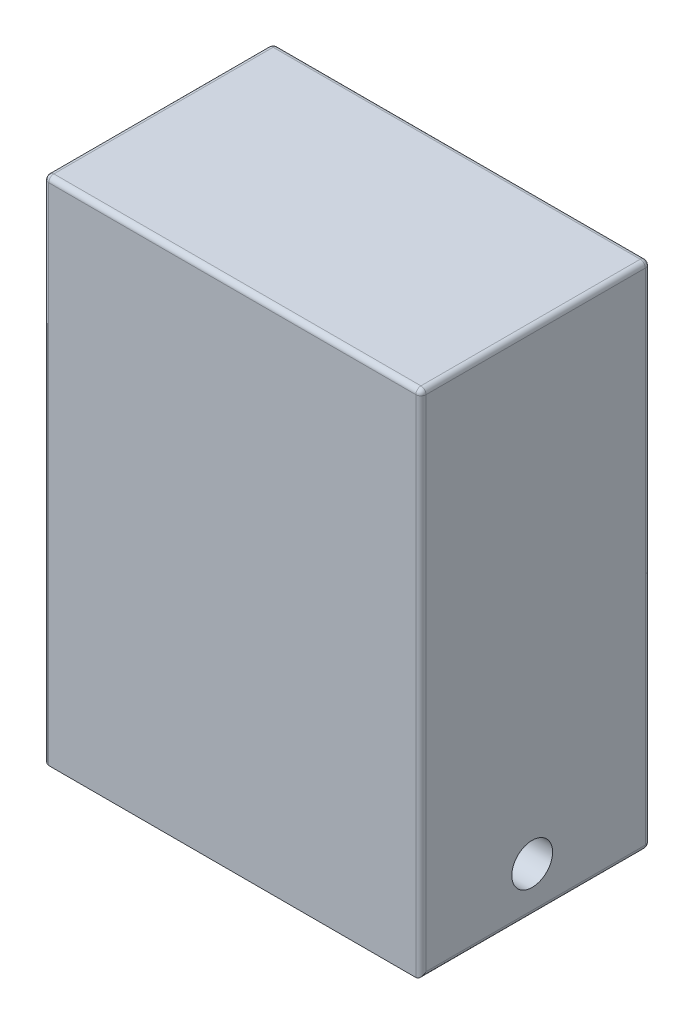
SolidWorks part; units mm, degrees
ref_plane "Front Plane" through (0, 0, 0) normal (0, 0, 1) x (1, 0, 0)
ref_plane "Top Plane" through (0, 0, 0) normal (0, 1, 0) x (1, 0, 0)
ref_plane "Right Plane" through (0, 0, 0) normal (1, 0, 0) x (0, 0, -1)
body saved out of another part "Stock-AirJetCasing-1"
sketch "Sketch1" plane through (0, 7.0644, 0) normal (0, 1, 0) x (1, 0, 0)
  line L0 (2.8086, -12.3746) -> (12.7, -12.3746) construction
  line L1 (12.7, -17.1291) -> (12.7, -7.62) construction
  circle A1 centre (6.4294, -12.7) radius 3.6354 construction
sketch "Sketch2" plane through (14.6844, 0, 0) normal (1, 0, 0) x (0, 0, -1)
  line L0 (-12.3746, 7.0644) -> (-12.3746, 0) construction
  line L3 (-3.175, 7.0644) -> (-20.6375, 7.0644) construction
  line L4 (-3.175, 18.6531) -> (-3.175, 0.3969) construction
  line L5 (-20.6375, 39.2906) -> (-20.6375, 0.3969) construction
  line L6 (-3.175, 0) -> (-20.6375, 0) construction
  line L7 (-3.175, 0) -> (-21.0344, 0) construction
  line L8 (-17.1291, 7.0644) -> (-7.62, 7.0644) construction
  point P19 (-12.3746, 3.5322)
hole_wizard "1/8 (0.125) Diameter Hole1" positions "3DSketch1" profile "Sketch3" hole size "1/8" standard "ANSI Inch"
sketch3d "3DSketch1"
  point P0 (14.6844, 3.5322, 12.3746)
sketch "Sketch3" plane through (14.6844, 3.5322, 12.3746) normal (0, 1, 0) x (0, 0, -1)
  line L0 (0, 0) -> (0, 5.0329)
  line L1 (0, 5.0329) -> (1.5875, 5.0329)
  line L2 (1.5875, 5.0329) -> (1.5875, 0)
  line L5 (1.5875, 0) -> (0, 0)
  line L11 (0, -6.35) -> (0, 107.95) construction
  dimension "Thru Hole Dia." = 3.175
  dimension "Thru Hole Depth" = 5.0329
fillet "Fillet1" radius 0.3969 16 edges at (-14.5681, 18.9338, 3.175) (14.5681, 18.9338, 3.175) (-14.5681, 0.1162, 3.175) (14.5681, 0.1162, 3.175) (-12.7, 7.9772, 3.175) (12.7, 7.9772, 3.175) (-10.795, 1.9844, 3.175) (0, 1.9844, 3.175) (10.795, 1.9844, 3.175) (14.6844, 9.525, 3.175) (-14.6844, 9.525, 3.175) (0, 0, 3.175) (-14.5681, 18.9338, 3.2912) (14.5681, 18.9338, 3.2912) (14.6844, 18.6531, 3.3734) (-14.6844, 18.6531, 3.3734)
sketch "Sketch4" plane through (-14.6844, 0, 0) normal (-1, 0, 0) x (0, 0, 1)
  line L0 (3.175, 21.8275) -> (21.0344, 21.8275) construction
  line L2 (3.175, 34.5275) -> (21.0344, 34.5275) construction
  line L3 (-21.0344, 23.415) -> (3.175, 23.415) construction
  line L4 (-21.0344, 32.94) -> (3.175, 32.94) construction
  line L7 (21.0344, 39.2906) -> (21.0344, 0) construction
  line L8 (3.175, 18.6531) -> (3.175, 37.1949) construction
  dimension "D1" = 1.5875
  dimension "D2" = 1.5875
sketch "Sketch5" plane through (-14.6844, 0, 0) normal (-1, 0, 0) x (0, 0, 1)
  line L1 (14.2875, 34.4005) -> (1.5875, 34.4005)
  line L2 (14.2875, 34.4005) -> (14.2875, 21.9545)
  line L3 (14.2875, 21.9545) -> (1.5875, 21.9545)
  line L4 (1.5875, 34.4005) -> (1.5875, 21.9545)
  line L6 (3.175, 18.6531) -> (3.175, 37.1949) construction
  line L7 (3.175, 21.8275) -> (21.0344, 21.8275) construction
  line L8 (3.175, 34.5275) -> (21.0344, 34.5275) construction
  dimension "D1" = 1.5875
  dimension "D2" = 12.7
  dimension "D3" = 0.127
  dimension "D4" = 0.127
extrude "Boss-Extrude1" add sketch "Sketch5" along normal blind 1.778 and the other way up to surface
sketch "Sketch6" plane through (-12.7, 0, 0) normal (1, 0, 0) x (0, 0, -1)
  line L0 (-3.9687, 33.1035) -> (-11.8135, 28.5744)
  line L1 (-1.5875, 34.4005) -> (-1.5875, 21.9545) construction
  line L2 (-1.5875, 33.2099) -> (-1.5875, 23.1451)
  line L3 (-11.8135, 27.7806) -> (-3.9687, 23.2515)
  line L4 (-1.5875, 28.1775) -> (-17.526, 28.1775) construction
  line L5 (-17.526, 4.5244) -> (-17.526, 35.1631) construction
  line L6 (-3.5719, 33.2099) -> (-1.5875, 33.2099)
  line L7 (-3.5719, 23.1451) -> (-1.5875, 23.1451)
  line L8 (-3.5719, 34.4005) -> (-1.5875, 34.4005) construction
  arc A0 (-11.8135, 28.5744) -> (-11.8135, 27.7806) centre (-11.5843, 28.1775) ccw
  arc A1 (-3.9687, 33.1035) -> (-3.5719, 33.2099) centre (-3.5719, 32.4161) cw
  arc A2 (-3.9687, 23.2515) -> (-3.5719, 23.1451) centre (-3.5719, 23.9389) ccw
  dimension "D3" = 0.7937
  dimension "D2" = 0.7937
  dimension "D4" = 0.7937
  dimension "D1" = 60
  dimension "D5" = 1.1906
  dimension "D6" = 60
  dimension "D7" = 1.9844
sketch "Sketch7" plane through (-16.4624, 0, 0) normal (-1, 0, 0) x (0, 0, 1)
  line L0 (1.5875, 34.4005) -> (1.5875, 21.9545) construction
  line L1 (3.5719, 23.1451) -> (1.5875, 23.1451)
  line L2 (4.2593, 23.542) -> (6.821, 27.9791)
  line L3 (1.5875, 21.9545) -> (14.2875, 21.9545) construction
  line L4 (1.5875, 28.1775) -> (14.2875, 28.1775) construction
  line L5 (14.2875, 21.9545) -> (14.2875, 34.4005) construction
  line L6 (6.821, 28.3759) -> (4.2593, 32.813)
  line L7 (1.5875, 23.1451) -> (1.5875, 33.2099)
  line L8 (1.5875, 33.2099) -> (3.5719, 33.2099)
  arc A0 (6.821, 27.9791) -> (6.821, 28.3759) centre (6.4773, 28.1775) ccw
  arc A1 (3.5719, 33.2099) -> (4.2593, 32.813) centre (3.5719, 32.4161) cw
  arc A2 (4.2593, 23.542) -> (3.5719, 23.1451) centre (3.5719, 23.9389) cw
  point P19 (4.0301, 23.1451)
  dimension "D4" = 0.7937
  dimension "D1" = 30
  dimension "D2" = 1.1906
  dimension "D3" = 0.3969
  dimension "D5" = 1.9844
loft "Cut-Loft1" cut profiles "Sketch6", "Sketch7"
sketch "Sketch9" plane through (0, 21.9545, 0) normal (0, -1, 0) x (1, 0, 0)
  line L1 (-12.7, 1.5875) -> (-14.8114, 1.5875)
  line L2 (-12.7, 1.5875) -> (-12.7, 3.175)
  line L3 (-12.7, 3.175) -> (-14.8114, 3.175)
  line L4 (-14.8114, 1.5875) -> (-14.8114, 3.175)
  line L5 (-13.0969, 3.175) -> (-14.2875, 3.175) construction
  line L6 (-14.6844, 14.2875) -> (-14.6844, 1.5875) construction
  dimension "D1" = 0.127
extrude "Cut-Extrude1" cut sketch "Sketch9" against normal up to surface (12.446 mm away)
fillet "Fillet3" radius 0.3969 44 edges at (-15.5734, 34.4005, 14.2875) (-14.5681, 34.4005, 3.2912) (-12.7, 34.4005, 3.3734) (-15.5734, 21.9545, 14.2875) (-14.5681, 21.9545, 3.2912) (-16.4624, 28.1775, 14.2875) (-16.4624, 34.4005, 7.9375) (-16.4624, 21.9545, 7.9375) (-13.7557, 23.1451, 3.175) (-15.6369, 21.9545, 1.5875) (-12.7, 21.9545, 3.3734) (-15.6369, 34.4005, 1.5875) (-13.7557, 33.2099, 3.175) (-12.8984, 34.4005, 3.175) (-14.5494, 34.4005, 3.175) (-14.8114, 33.8052, 1.5875) (-14.8114, 34.4005, 2.3812) (-14.8114, 22.5498, 1.5875) (-12.8984, 21.9545, 3.175) (-14.5494, 21.9545, 3.175) (-14.8114, 21.9545, 2.3812)
sketch "Sketch10" plane through (0, 1.9844, 0) normal (0, 1, 0) x (1, 0, 0)
  line L0 (-12.7, -9.525) -> (12.7, -9.525) construction
  line L1 (-12.7, -3.5719) -> (-12.7, -17.526) construction
  line L2 (12.7, -7.62) -> (12.7, -3.5719) construction
  line L3 (-14.6844, -3.5719) -> (-14.6844, -20.6375) construction
  line L4 (-13.0969, -3.175) -> (-8.89, -3.175) construction
  point P6 (-4.5244, -9.525)
  dimension "D1" = 10.16
  dimension "D2" = 6.35
hole_wizard "#8 Clearance Slot1" positions "Sketch12" profile "Sketch11" size "#8" standard "ANSI Inch"
sketch "Sketch12" plane through (0, 1.9844, 0) normal (0, 1, 0) x (1, 0, 0)
  line L0 (-9.6044, -9.525) -> (0.5556, -9.525) construction
  line L1 (-12.7, -9.525) -> (12.7, -9.525) construction
  point P0 (-4.5244, -9.525)
  dimension "D1" = 10.16
sketch "Sketch11" plane through (-4.5244, 1.9844, 9.525) normal (1, 0, 0) x (0, 0, 1)
  line L0 (0, 0) -> (0, 1.9844)
  line L1 (0, 1.9844) -> (2.2479, 1.9844)
  line L2 (2.2479, 1.9844) -> (2.2479, 0)
  line L5 (2.2479, 0) -> (0, 0)
  line L11 (0, -6.35) -> (0, 107.95) construction
  dimension "Thru Hole Dia." = 4.4958
  dimension "Thru Hole Depth" = 1.9844
equation "\"D1@Boss-Extrude1\"=0.20in-0.13"
